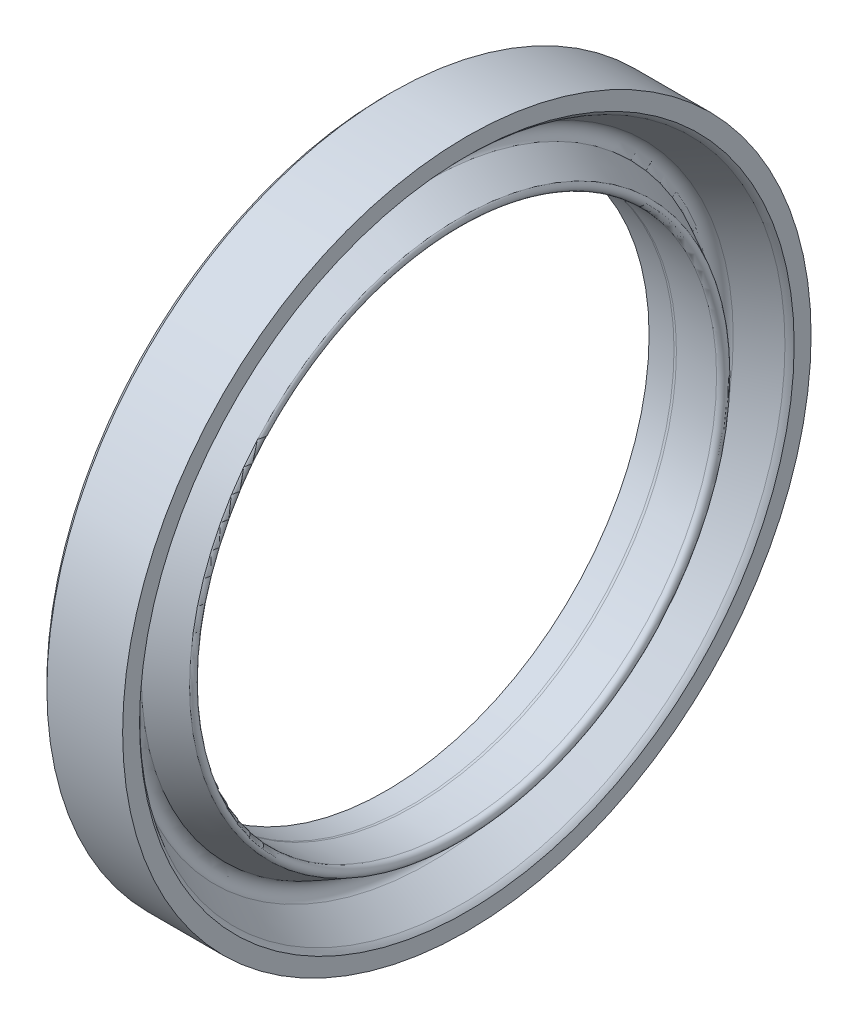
SolidWorks part; units mm, degrees
ref_plane "Plan1" through (0, 0, 0) normal (0, 0, 1) x (1, 0, 0)
ref_plane "Plan2" through (0, 0, 0) normal (0, 1, 0) x (1, 0, 0)
ref_plane "Plan3" through (0, 0, 0) normal (1, 0, 0) x (0, 0, -1)
sketch "Esquisse1" plane through (0, 0, 0) normal (0, 0, 1) x (-1, 0, 0)
  line L0 (9.1, 45.5) -> (9.75, 44.85)
  line L3 (0, 45.5) -> (9.1, 45.5)
  line L4 (0, 45.5) -> (0, 41.8054)
  line L5 (0.325, 41.2425) -> (4.3741, 38.9047)
  line L6 (9.75, 44.85) -> (9.75, 33.8933)
  line L7 (4.5597, 36.783) -> (0.7392, 33.5772)
  line L8 (0, 0) -> (0, 14) construction
  line L9 (-2.434, 0) -> (3.3798, 0) construction
  line L10 (9.75, 33.8933) -> (6.6711, 33.8933)
  line L11 (6.3347, 33.849) -> (1.3, 32.5)
  arc A0 (6.6711, 33.8933) -> (6.3347, 33.849) centre (6.6711, 32.5933) ccw
  arc A1 (4.3741, 38.9047) -> (4.5597, 36.783) centre (3.7241, 37.7789) cw
  arc A2 (0.325, 41.2425) -> (0, 41.8054) centre (0.65, 41.8054) cw
  arc A4 (0.7392, 33.5772) -> (1.3, 32.5) centre (1.139, 33.1008) ccw
  point P10 (2, 10.4287)
  point P13 (1.8406, 11.685)
  point P20 (1.8406, 11.685)
  point P24 (0, 41.4301)
  dimension "D7" = 2
  dimension "D9" = 1.8406
sketch "Esquisse2" plane through (0, 0, 0) normal (0, 0, 1) x (1, 0, 0)
  line L8 (-9.1, -42.5) -> (-9.75, -41.85)
  line L9 (-9.75, -41.85) -> (-9.75, -32.5)
  line L10 (0.25, -42.5) -> (-9.1, -42.5)
  line L11 (0.25, -42.5) -> (0.25, -40.412)
  line L12 (-0.325, -39.8491) -> (-4.3741, -37.5114)
  line L13 (-4.5597, -35.3897) -> (-0.636, -33.356)
  line L14 (-6.3347, -32.4557) -> (-1.1968, -32.2787)
  line L15 (-9.75, -32.5) -> (-6.6711, -32.5)
  line L16 (2.434, 0) -> (-3.3798, 0) construction
  arc A4 (0.25, -40.412) -> (-0.325, -39.8491) centre (-1.9733, -42.1079) ccw
  arc A5 (-6.6711, -32.5) -> (-6.3347, -32.4557) centre (-6.6711, -31.2) ccw
  arc A6 (-4.5597, -35.3897) -> (-4.3741, -37.5114) centre (-3.7241, -36.3855) ccw
  arc A7 (-0.636, -33.356) -> (-1.1968, -32.2787) centre (-1.0358, -32.8795) ccw
  dimension "D1" = 32.5
  dimension "D2" = 42.5
  dimension "D3" = 10
revolve "Révolution2" add sketch "Esquisse2" angle 360 about L9
